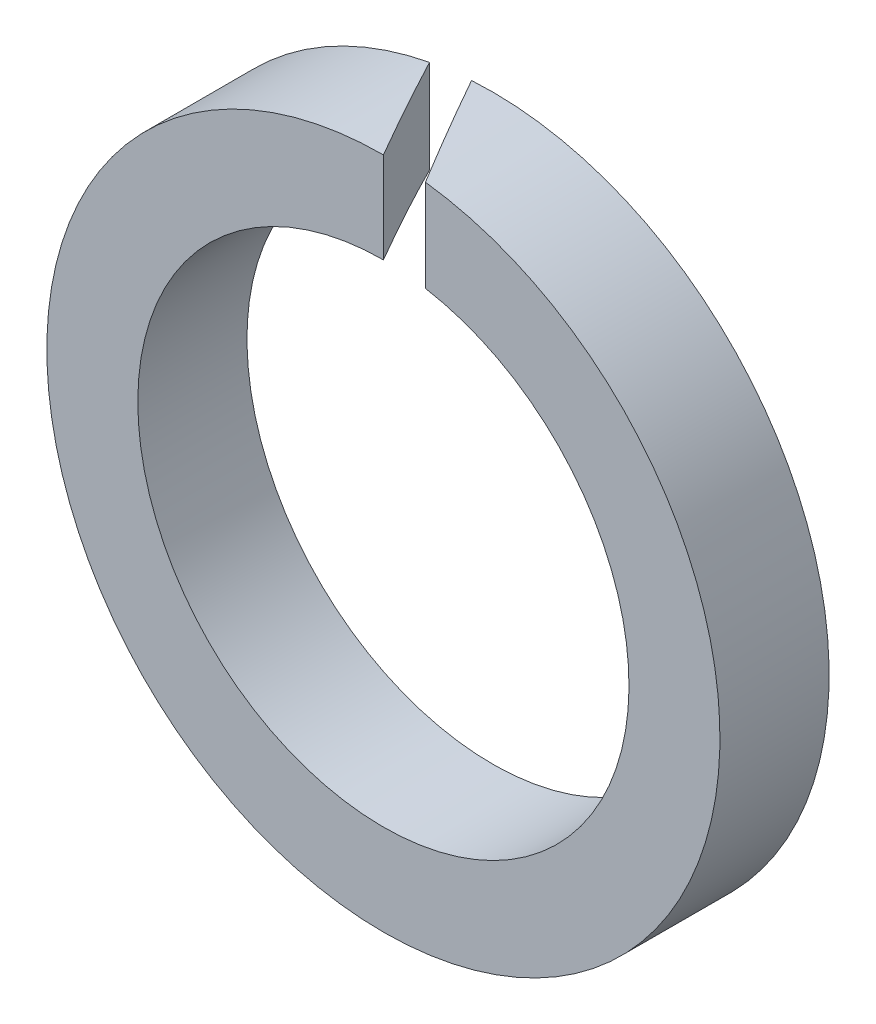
SolidWorks part; units mm, degrees
ref_plane "face" through (0, 0, 0) normal (0, 0, 1) x (1, 0, 0)
ref_plane "dessus" through (0, 0, 0) normal (0, 1, 0) x (1, 0, 0)
ref_plane "profil" through (0, 0, 0) normal (1, 0, 0) x (0, 0, -1)
sketch "Esquisse1" plane through (0, 0, 0) normal (0, 0, 1) x (1, 0, 0)
  circle A0 centre (0, 0) radius 18.5
  dimension "D1" = 37
extrude "Base-Extrusion" add sketch "Esquisse1" against normal blind 6
sketch "Esquisse2" plane through (0, 0, 0) normal (0, 0, 1) x (1, 0, 0)
  circle A0 centre (0, 0) radius 13.5
  dimension "D1" = 27
extrude "Enlèv. mat.-Extru.1" cut sketch "Esquisse2" against normal blind 6
ref_plane "Plan1" through (0, 18.5, 0) normal (0, 1, 0) x (-1, 0, 0)
sketch "Esquisse3" plane through (0, 18.5, 0) normal (0, 1, 0) x (-1, 0, 0)
  line L0 (0, 0) -> (3.4641, -6)
  line L1 (13.5, 0) -> (-13.5, 0) construction
  line L3 (1.1547, -6) -> (3.4641, -6)
  line L8 (-2.3094, 0) -> (1.1547, -6)
  line L9 (0, 0) -> (-2.3094, 0)
  dimension "D1" = 60
  dimension "D2" = 2
extrude "Enlèv. mat.-Extru.2" cut sketch "Esquisse3" against normal blind 10
